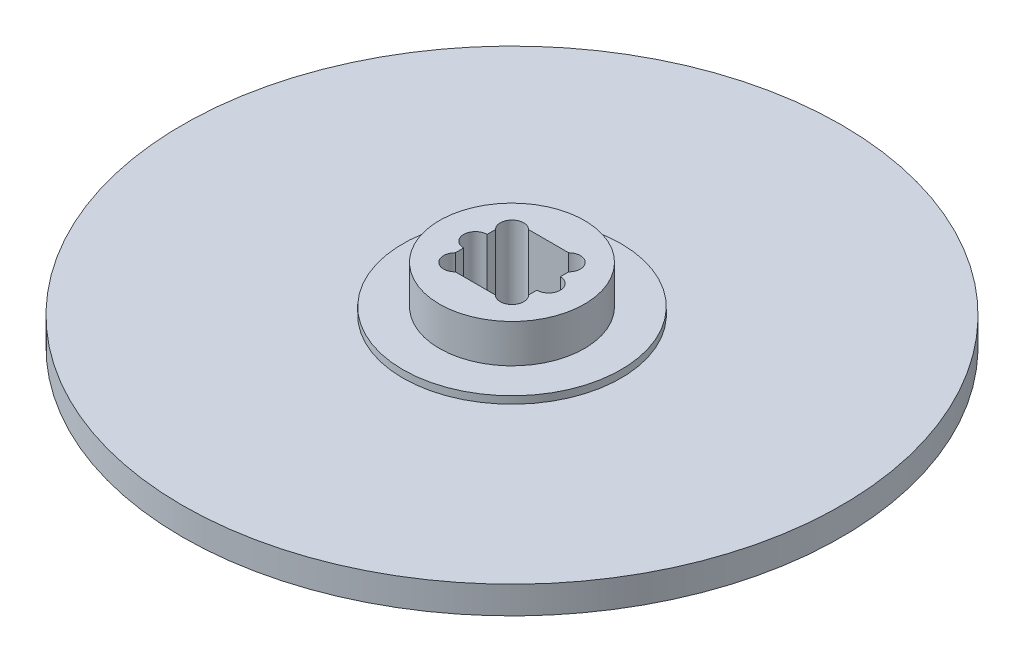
SolidWorks part; units mm, degrees
ref_plane "Plan de face" through (0, 0, 0) normal (0, 0, 1) x (1, 0, 0)
ref_plane "Plan de dessus" through (0, 0, 0) normal (0, 1, 0) x (1, 0, 0)
ref_plane "Plan de droite" through (0, 0, 0) normal (1, 0, 0) x (0, 0, -1)
sketch "Esquisse1" plane through (0, 0, 0) normal (0, 1, 0) x (1, 0, 0)
  circle A0 centre (0, 0) radius 45
extrude "Boss.-Extru.1" add sketch "Esquisse1" along normal blind 3.75
sketch "Esquisse2" plane through (0, 3.75, 0) normal (0, 1, 0) x (1, 0, 0)
  circle A0 centre (0, 0) radius 9.9
extrude "Boss.-Extru.2" add sketch "Esquisse2" along normal blind 6.25
sketch "Esquisse3" plane through (0, 10, 0) normal (0, 1, 0) x (1, 0, 0)
  line L0 (0, -5.05) -> (0, 9.9) construction
  line L1 (-5, 0) -> (8.3606, 0) construction
  line L2 (-2.7373, 5) -> (2.7373, 5)
  line L3 (-5, 2.7373) -> (-5, -2.7373)
  line L4 (-2.7373, -5) -> (2.7373, -5)
  line L5 (5, 2.7373) -> (5, -2.7373)
  line L6 (-5, 5) -> (5, -5) construction
  line L7 (-5, -5) -> (5, 5) construction
  arc A0 (-2.7373, 5) -> (-5, 2.7373) centre (-3.8686, 3.8686) ccw
  circle A1 centre (0, 0) radius 9.9 construction
  arc A2 (2.7373, 5) -> (5, 2.7373) centre (3.8686, 3.8686) cw
  arc A3 (2.7373, -5) -> (5, -2.7373) centre (3.8686, -3.8686) ccw
  arc A4 (-2.7373, -5) -> (-5, -2.7373) centre (-3.8686, -3.8686) cw
  point P0 (0, 0)
  point P8 (-3.8686, 3.8686)
  dimension "D3" = 1.6
  dimension "D1" = 10
  dimension "D2" = 10
extrude "Enlèv. mat.-Extru.1" cut sketch "Esquisse3" against normal through all
sketch "Esquisse4" plane through (0, 0, 0) normal (0, -1, 0) x (-1, 0, 0)
  circle A0 centre (5, 0) radius 1.6
  circle A1 centre (-5, 0) radius 1.6
  dimension "D1" = 5
extrude "Enlèv. mat.-Extru.2" cut sketch "Esquisse4" against normal blind 10
sketch "Esquisse5" plane through (0, 3.75, 0) normal (0, 1, 0) x (1, 0, 0)
  circle A0 centre (0, 0) radius 9.9
  circle A1 centre (0, 0) radius 14.9
  dimension "D1" = 5
extrude "Boss.-Extru.3" add sketch "Esquisse5" along normal blind 1
